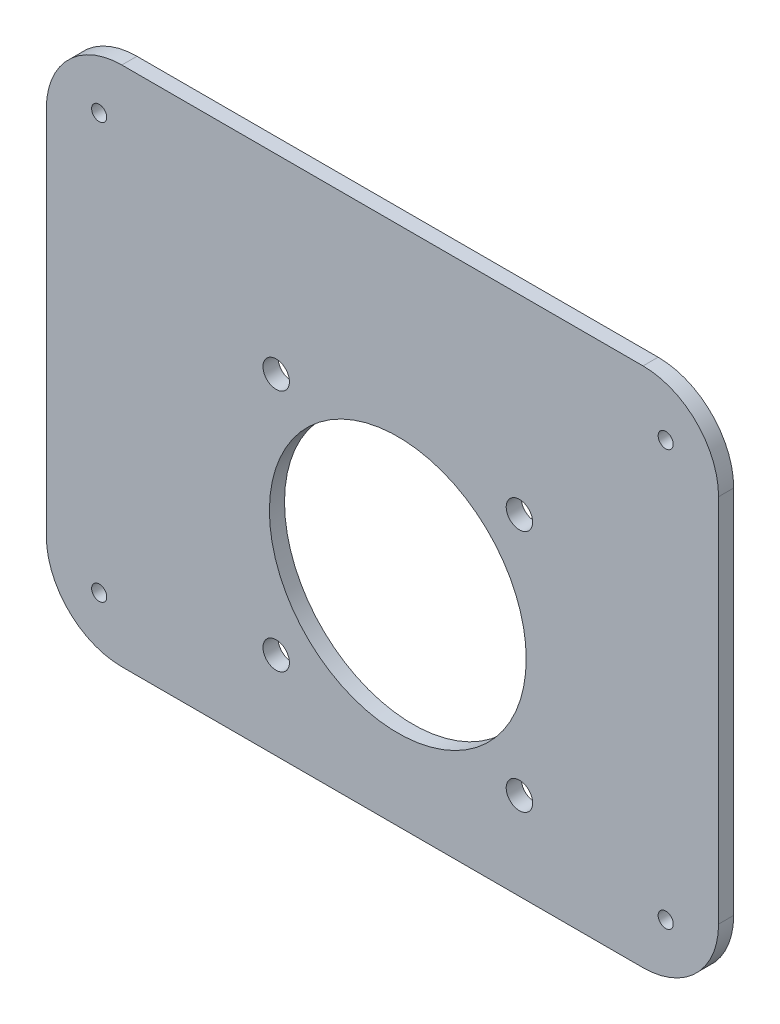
SolidWorks part; units mm, degrees
ref_plane "前视基准面" through (0, 0, 0) normal (0, 0, 1) x (1, 0, 0)
ref_plane "上视基准面" through (0, 0, 0) normal (0, 1, 0) x (1, 0, 0)
ref_plane "右视基准面" through (0, 0, 0) normal (1, 0, 0) x (0, 0, -1)
sketch "草图1" plane through (0, 0, 0) normal (0, 0, 1) x (1, 0, 0)
  line L0 (10, 0) -> (10, -10)
  line L1 (10, 0) -> (79, 0)
  line L2 (0, -10) -> (0, -59)
  line L3 (10, -69) -> (79, -69)
  line L4 (89, -10) -> (89, -59)
  line L5 (10, -10) -> (0, -10)
  line L6 (44.5, 0) -> (44.5, -69) construction
  line L7 (0, -34.5) -> (89, -34.5)
  line L8 (79, -10) -> (89, -10)
  line L9 (79, 0) -> (79, -10)
  line L10 (79, -59) -> (89, -59)
  line L11 (79, -69) -> (79, -59)
  line L12 (10, -59) -> (0, -59)
  line L13 (10, -69) -> (10, -59)
  arc A0 (79, 0) -> (89, -10) centre (79, -10) cw
  arc A1 (0, -59) -> (10, -69) centre (10, -59) ccw
  arc A2 (79, -69) -> (89, -59) centre (79, -59) ccw
  arc A3 (10, 0) -> (0, -10) centre (10, -10) ccw
  circle A4 centre (7, -7) radius 1
  circle A5 centre (82, -7) radius 1
  circle A6 centre (82, -62) radius 1
  circle A7 centre (7, -62) radius 1
  point P7 (89, 0)
  point P10 (0, -69)
  point P15 (0, 0)
  dimension "D3" = 10
  dimension "D5" = 3
  dimension "D6" = 2
  dimension "D1" = 89
  dimension "D2" = 69
  dimension "D4" = 3
extrude "凸台-拉伸1" add sketch "草图1" against normal blind 2 contours L6 L1 L0 L5 L2 L7 | L1 L6 L7 L4 L8 L9 | L6 L7 L2 L12 L13 L3 | L7 L6 L3 L11 L10 L4 | L0 A3 L5 A4 | A0 L9 L8 A5 | L12 A1 L13 A7 | L11 A2 L10 A6
sketch "草图2" plane through (0, 0, 0) normal (0, 0, 1) x (1, 0, 0)
  circle A0 centre (30.4339, -25.2308) radius 1.75
  circle A1 centre (62.6339, -25.2308) radius 1.75
  circle A2 centre (46.5339, -41.3308) radius 17
  circle A3 centre (30.4339, -57.4308) radius 1.75
  circle A4 centre (62.6339, -57.4308) radius 1.75
extrude "切除-拉伸1" cut sketch "草图2" against normal up to next
